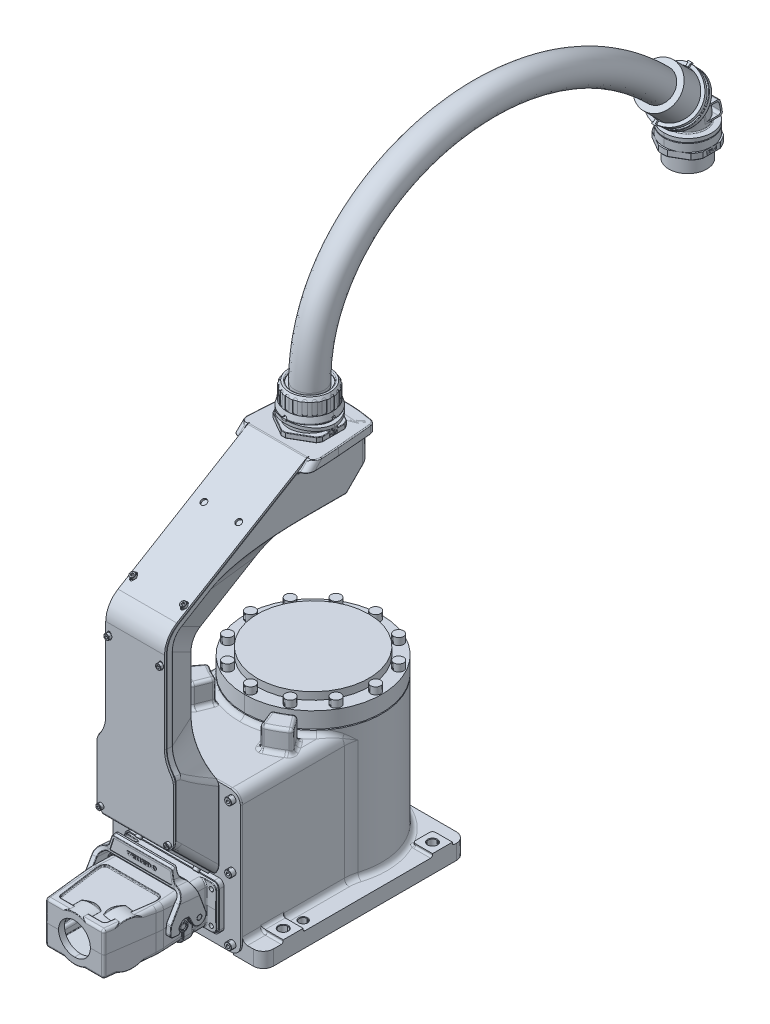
SolidWorks part; units mm, degrees
ref_plane "前视基准面" through (0, 0, 0) normal (0, 0, 1) x (1, 0, 0)
ref_plane "上视基准面" through (0, 0, 0) normal (0, 1, 0) x (1, 0, 0)
ref_plane "右视基准面" through (0, 0, 0) normal (1, 0, 0) x (0, 0, -1)
imported_body "MB10SC-700.sldasm-Part-1-1-solid1"
imported_body "MB10SC-700.sldasm-Part-2-1-solid1"
imported_body "MB10SC-700.sldasm-Part-3-1-solid1"
imported_body "MB10SC-700.sldasm-Part-4-1-solid1"
imported_body "MB10SC-700.sldasm-Part-5-1-solid1"
imported_body "MB10SC-700.sldasm-Part-6-1-solid1"
imported_body "MB10SC-700.sldasm-Part-7-1-solid1"
imported_body "MB10SC-700.sldasm-Part-8-1-solid1"
imported_body "MB10SC-700.sldasm-Part-9-1-surface1"
imported_body "MB10SC-700.sldasm-Part-9-1-surface2"
imported_body "MB10SC-700.sldasm-Part-9-1-surface3"
imported_body "MB10SC-700.sldasm-Part-9-1-surface4"
imported_body "MB10SC-700.sldasm-Part-9-1-surface5"
imported_body "MB10SC-700.sldasm-Part-9-1-surface6"
imported_body "MB10SC-700.sldasm-Part-9-1-surface7"
imported_body "MB10SC-700.sldasm-Part-9-1-surface8"
imported_body "MB10SC-700.sldasm-Part-9-1-surface9"
imported_body "MB10SC-700.sldasm-Part-9-1-surface10"
imported_body "MB10SC-700.sldasm-Part-9-1-surface11"
imported_body "MB10SC-700.sldasm-Part-9-1-surface12"
imported_body "MB10SC-700.sldasm-Part-9-1-surface13"
imported_body "MB10SC-700.sldasm-Part-9-1-surface14"
imported_body "MB10SC-700.sldasm-Part-10-1-solid1"
delete or keep bodies "实体-删除/保留 1" type delete bodies bodies 130 111 112 110 113
delete or keep bodies "实体-删除/保留 2" type delete bodies bodies 121 119 120 122 123 125 124 129 128 127 126
other "移动面1" parameters "D1"=3.8
